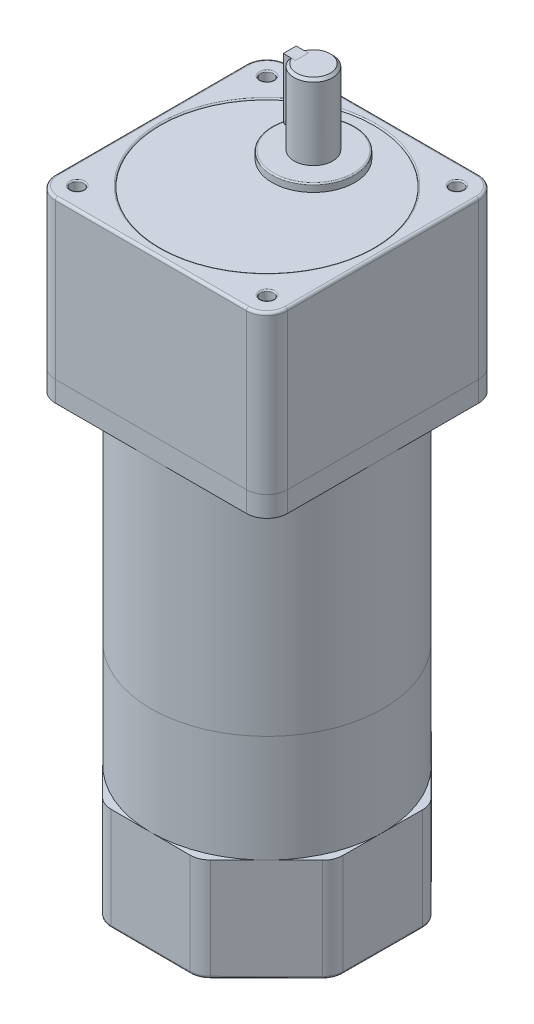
SolidWorks part; units mm, degrees
ref_plane "前视基准面" through (0, 0, 0) normal (0, 0, 1) x (1, 0, 0)
ref_plane "上视基准面" through (0, 0, 0) normal (0, 1, 0) x (1, 0, 0)
ref_plane "右视基准面" through (0, 0, 0) normal (1, 0, 0) x (0, 0, -1)
sketch "草图1" plane through (0, 0, 0) normal (0, 1, 0) x (1, 0, 0)
  line L1 (-37, -45) -> (37, -45)
  line L2 (-45, -37) -> (-45, 37)
  line L3 (-37, 45) -> (37, 45)
  line L4 (45, -37) -> (45, 37)
  line L5 (-45, -45) -> (45, 45) construction
  line L6 (-45, 45) -> (45, -45) construction
  arc A0 (-45, 37) -> (-37, 45) centre (-37, 37) cw
  arc A1 (-37, -45) -> (-45, -37) centre (-37, -37) cw
  arc A2 (37, 45) -> (45, 37) centre (37, 37) cw
  arc A3 (37, -45) -> (45, -37) centre (37, -37) ccw
  point P0 (0, 0)
  dimension "D1" = 8
extrude "凸台-拉伸1" add sketch "草图1" against normal blind 61
sketch "草图2" plane through (0, -61, 0) normal (0, -1, 0) x (1, 0, 0)
  line L0 (-37, 45) -> (37, 45) construction
  line L1 (-37, -45) -> (37, -45)
  line L2 (-45, -37) -> (-45, 37)
  line L3 (-37, 45) -> (37, 45)
  line L4 (45, -37) -> (45, 37)
  line L5 (-45, -45) -> (45, 45) construction
  line L6 (-45, 45) -> (45, -45) construction
  arc A0 (-37, -45) -> (-45, -37) centre (-37, -37) cw
  arc A1 (37, -45) -> (45, -37) centre (37, -37) ccw
  arc A2 (37, 45) -> (45, 37) centre (37, 37) cw
  arc A3 (-45, 37) -> (-37, 45) centre (-37, 37) cw
  point P0 (0, 0)
  dimension "D1" = 8
extrude "凸台-拉伸2" add sketch "草图2" along normal blind 8 separate body
sketch "草图3" plane through (0, -69, 0) normal (0, -1, 0) x (1, 0, 0)
  circle A0 centre (0, 0) radius 45
extrude "凸台-拉伸3" add sketch "草图3" along normal blind 84 separate body
sketch "草图4" plane through (0, -153, 0) normal (0, -1, 0) x (1, 0, 0)
  circle A0 centre (0, 0) radius 45
extrude "凸台-拉伸4" add sketch "草图4" along normal blind 41.5 separate body
sketch "草图5" plane through (0, -194.5, 0) normal (0, -1, 0) x (1, 0, 0)
  line L1 (15.1674, 45.0537) -> (-15.4843, 44.9458)
  line L2 (-21.1328, 42.5827) -> (-42.7305, 20.8324)
  line L3 (-45.0537, 15.1674) -> (-44.9458, -15.4843)
  line L4 (-42.5827, -21.1328) -> (-20.8324, -42.7305)
  line L5 (-15.1674, -45.0537) -> (15.4843, -44.9458)
  line L6 (21.1328, -42.5827) -> (42.7305, -20.8324)
  line L7 (45.0537, -15.1674) -> (44.9458, 15.4843)
  line L8 (42.5827, 21.1328) -> (20.8324, 42.7305)
  circle A0 centre (0, 0) radius 45 construction
  arc A1 (44.9458, 15.4843) -> (42.5827, 21.1328) centre (36.9458, 15.4561) ccw
  arc A2 (42.7305, -20.8324) -> (45.0537, -15.1674) centre (37.0537, -15.1955) ccw
  arc A3 (15.4843, -44.9458) -> (21.1328, -42.5827) centre (15.4561, -36.9458) ccw
  arc A4 (-20.8324, -42.7305) -> (-15.1674, -45.0537) centre (-15.1955, -37.0537) ccw
  arc A5 (-44.9458, -15.4843) -> (-42.5827, -21.1328) centre (-36.9458, -15.4561) ccw
  arc A6 (-42.7305, 20.8324) -> (-45.0537, 15.1674) centre (-37.0537, 15.1955) ccw
  arc A7 (15.1674, 45.0537) -> (20.8324, 42.7305) centre (15.1955, 37.0537) cw
  arc A8 (-15.4843, 44.9458) -> (-21.1328, 42.5827) centre (-15.4561, 36.9458) ccw
  dimension "D1" = 8
extrude "凸台-拉伸5" add sketch "草图5" along normal blind 40 separate body
fillet "圆角1" radius 1 16 edges at (44.9997, -234.5, 0.1584) (44.4555, -234.5, -18.231) (31.9316, -234.5, -31.7076) (18.5436, -234.5, -44.326) (0.1584, -234.5, -44.9997) (-18.231, -234.5, -44.4555) (-31.7076, -234.5, -31.9316) (-44.326, -234.5, -18.5436) (-44.9997, -234.5, -0.1584) (-44.4555, -234.5, 18.231) (-31.9316, -234.5, 31.7076) (-18.5436, -234.5, 44.326) (-0.1584, -234.5, 44.9997) (18.231, -234.5, 44.4555) (31.7076, -234.5, 31.9316) (44.326, -234.5, 18.5436)
fillet "圆角2" radius 1 8 edges at (0, 0, -45) (42.6569, 0, -42.6569) (45, 0, 0) (42.6569, 0, 42.6569) (0, 0, 45) (-42.6569, 0, 42.6569) (-45, 0, 0) (-42.6569, 0, -42.6569)
sketch "草图6" plane through (0, 0, 0) normal (0, 1, 0) x (1, 0, 0)
  point P19 (36.7696, -36.7696)
  point P20 (-36.7696, -36.7696)
  point P21 (-36.7696, 36.7696)
  point P22 (36.7696, 36.7696)
hole_wizard "M6 螺纹孔1" positions "3D草图1" profile "草图7" tap size "M6" standard "GB"
sketch3d "3D草图1"
  point P0 (36.7696, 0, 36.7696)
  point P3 (-36.7696, 0, 36.7696)
  point P6 (-36.7696, 0, -36.7696)
  point P9 (36.7696, 0, -36.7696)
sketch "草图7" plane through (36.7696, 0, 36.7696) normal (1, 0, 0) x (0, 0, 1)
  line L0 (0, 0) -> (0, 18.5022)
  line L1 (0, 18.5022) -> (2.5, 17)
  line L2 (2.5, 17) -> (2.5, 0)
  line L5 (2.5, 0) -> (0, 0)
  line L10 (0, 18.5022) -> (-2.5, 17) construction
  line L11 (0, -6.35) -> (0, 107.95) construction
  dimension "螺纹孔钻头直径" = 5
  dimension "螺纹孔钻头深度" = 17
  dimension "导头角度" = 118
sketch "草图8" plane through (0, -69, 0) normal (0, -1, 0) x (1, 0, 0)
  circle A1 centre (-36.7696, 36.7696) radius 3.5
  circle A2 centre (36.7696, 36.7696) radius 3.5
  circle A3 centre (36.7696, -36.7696) radius 3.5
  circle A4 centre (-36.7696, -36.7696) radius 3.5
extrude "切除-拉伸1" cut sketch "草图8" against normal blind 34
fillet "圆角3" radius 0.5 4 edges at (36.7696, 0, -34.2696) (-36.7696, 0, -34.2696) (-36.7696, 0, 39.2696) (36.7696, 0, 39.2696)
sketch "草图9" plane through (0, 0, 0) normal (0, 1, 0) x (1, 0, 0)
  circle A0 centre (0, 18) radius 16
extrude "凸台-拉伸6" add sketch "草图9" along normal blind 3 separate body
fillet "圆角4" radius 0.5 1 edges at (0, 3, -2)
sketch "草图10" plane through (0, 3, 0) normal (0, 1, 0) x (1, 0, 0)
  circle A0 centre (0, 18) radius 7.5
extrude "凸台-拉伸7" add sketch "草图10" along normal blind 29 separate body
sketch "草图11" plane through (0, 0, 0) normal (0, 1, 0) x (1, 0, 0)
  circle A0 centre (0, 0) radius 41.4
extrude "切除-拉伸2" cut sketch "草图11" against normal blind 0.5
fillet "圆角5" radius 0.5 1 edges at (0, 0, 41.4)
ref_plane "基准面2" through (-7.5, 0, 0) normal (1, 0, 0) x (0, 0, -1)
sketch "草图13" plane through (-7.5, 0, 0) normal (1, 0, 0) x (0, 0, -1)
  line L1 (25.5, 32) -> (10.5, 32) construction
  line L2 (20.5, 9.5) -> (20.5, 32)
  line L3 (20.5, 32) -> (15.5, 32)
  line L4 (15.5, 32) -> (15.5, 9.5)
  arc A0 (15.5, 9.5) -> (20.5, 9.5) centre (18, 9.5) ccw
extrude "切除-拉伸6" cut sketch "草图13" along normal blind 3
sketch "草图14" plane through (-4.5, 0, 0) normal (-1, 0, 0) x (0, 0, 1)
  line L0 (-20.5, 9.5) -> (-20.5, 32)
  line L1 (-20.5, 32) -> (-15.5, 32)
  line L2 (-15.5, 32) -> (-15.5, 9.5)
  arc A0 (-20.5, 9.5) -> (-15.5, 9.5) centre (-18, 9.5) ccw
extrude "凸台-拉伸8" add sketch "草图14" along normal blind 5 separate body
chamfer "倒角2" distance 0.3 angle 45 4 edges at (-9.5, 32, -18) (-9.5, 20.75, -20.5) (-9.5, 7, -18) (-9.5, 20.75, -15.5)
chamfer "倒角3" distance 1 angle 45 1 edges at (7.5, 32, -18)
